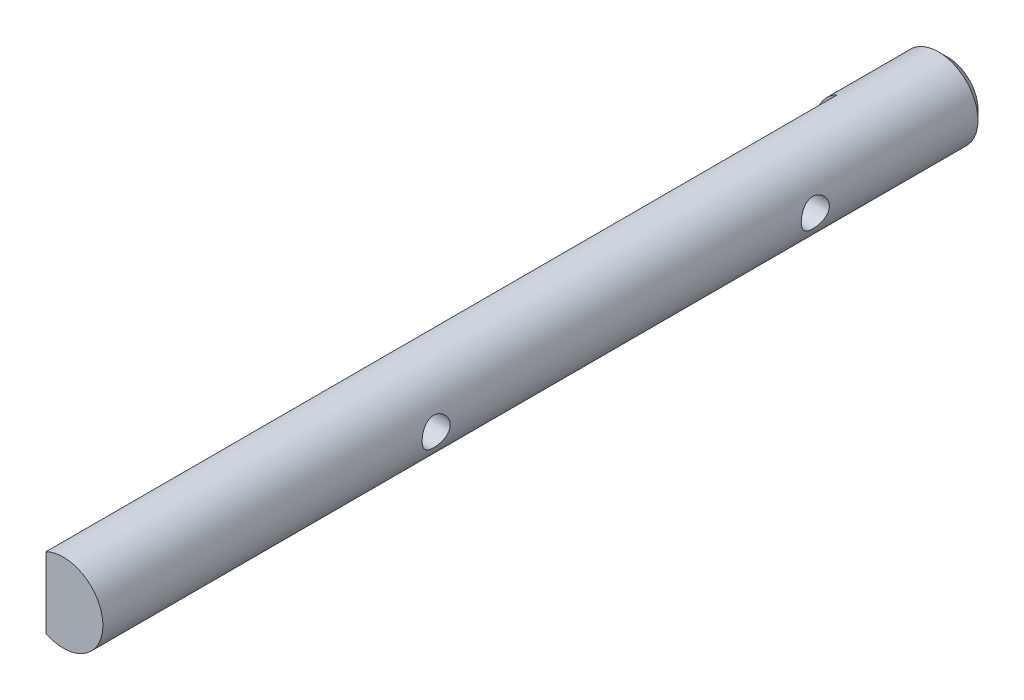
SolidWorks part; units mm, degrees
ref_plane "Front Plane" through (0, 0, 0) normal (0, 0, 1) x (1, 0, 0)
ref_plane "Top Plane" through (0, 0, 0) normal (0, 1, 0) x (1, 0, 0)
ref_plane "Right Plane" through (0, 0, 0) normal (1, 0, 0) x (0, 0, -1)
sketch "Sketch1" plane through (0, 0, 0) normal (0, 0, 1) x (1, 0, 0)
  circle A0 centre (0, 0) radius 3.175
  dimension "D1" = 6.35
extrude "Boss-Extrude1" add sketch "Sketch1" along normal blind 160.02
chamfer "Chamfer1" distance 0.762 angle 45 2 edges at (3.175, 0, 0) (3.175, 0, 160.02)
sketch "Sketch2" plane through (0, 0, 0) normal (1, 0, 0) x (0, 0, -1)
  line L1 (0, -2.413) -> (0, 2.413) construction
  line L2 (0, 0) -> (-160.02, 0) construction
  line L3 (-160.02, 2.413) -> (-160.02, -2.413) construction
  circle A0 centre (-13.843, 0) radius 1.1303
  circle A1 centre (-44.323, 0) radius 1.1303
  circle A2 centre (-97.663, 0) radius 1.1303
  circle A3 centre (-128.143, 0) radius 1.1303
  dimension "D2" = 2.2606
  dimension "D1" = 13.843
  dimension "D3" = 30.48
  dimension "D4" = 53.34
  dimension "D5" = 30.48
extrude "Cut-Extrude1" cut sketch "Sketch2" against normal through all and the other way through all
sketch "Sketch3" plane through (0, 0, 0) normal (1, 0, 0) x (0, 0, -1)
  line L0 (-0.762, 3.175) -> (-159.258, 3.175) construction
  line L1 (-7.493, 3.175) -> (-134.493, 3.175)
  line L2 (-7.493, 3.175) -> (-7.493, -3.175)
  line L3 (-7.493, -3.175) -> (-134.493, -3.175)
  line L4 (-134.493, 3.175) -> (-134.493, -3.175)
  line L5 (-44.323, 0) -> (-97.663, 0) construction
  line L6 (-70.993, 3.175) -> (-70.993, -3.175) construction
  point P13 (-70.993, 0)
  dimension "D1" = 127
extrude "Cut-Extrude2" cut sketch "Sketch3" along normal blind 1.778 from offset 3.175
sketch "Sketch4" plane through (0, 0, 160.02) normal (0, 0, -1) x (-1, 0, 0)
  circle A0 centre (0, 0) radius 3.175 construction
  circle A1 centre (0, 0) radius 3.175
extrude "Cut-Extrude3" cut sketch "Sketch4" along normal blind 88.9
